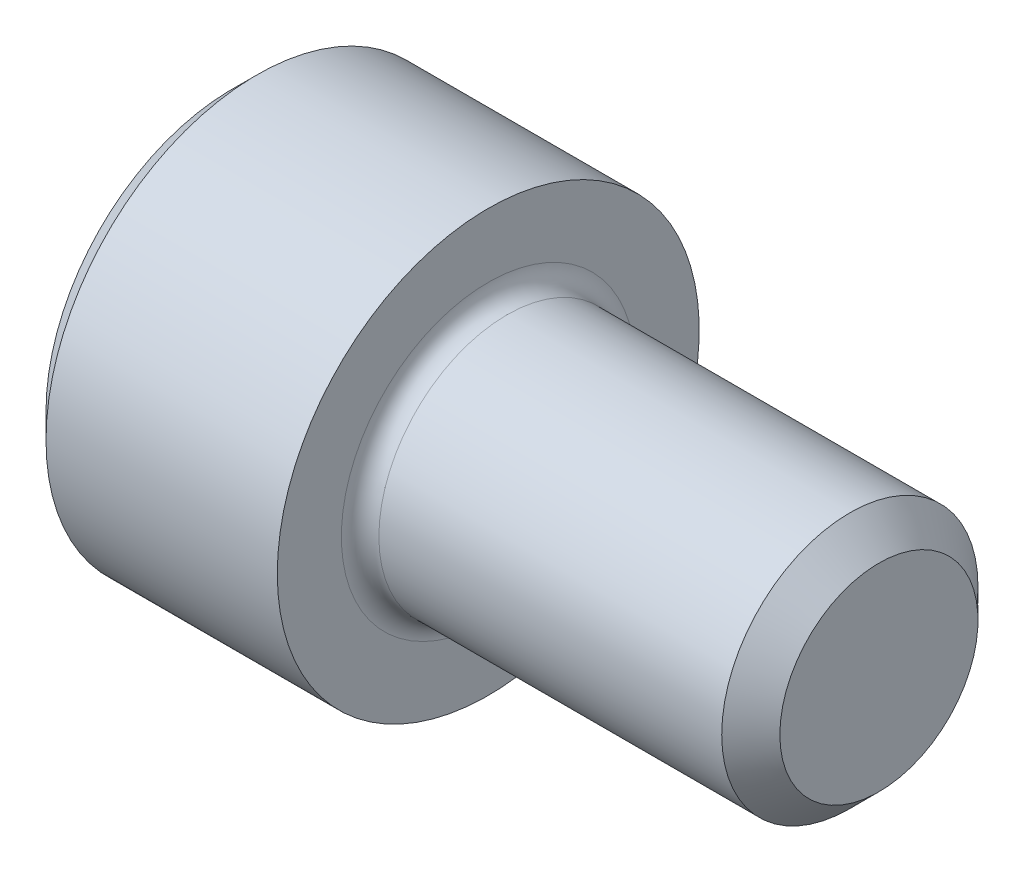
SolidWorks part; units mm, degrees
revolve "Base-Revolve" add sketch "BodySke"
sketch "BodySke" plane through (0, 0, 0) normal (0, 0, 1) x (1, 0, 0)
  line L0 (0, 0) -> (0, 3.0226)
  line L1 (0.4064, 3.429) -> (4.1656, 3.429)
  line L2 (4.1656, 3.429) -> (4.1656, 2.0828)
  line L3 (4.1656, 2.0828) -> (10.0432, 2.0828)
  line L4 (10.5156, 1.6104) -> (10.5156, 0)
  line L5 (10.5156, 0) -> (0, 0)
  line L6 (-31.75, 0) -> (127, 0) construction
  line L7 (0, 3.0226) -> (0.4064, 3.429)
  line L8 (10.5156, 1.6104) -> (10.0432, 2.0828)
  line L9 (0, -3.0226) -> (0.4064, -3.429) construction
  line L10 (10.5156, -1.6104) -> (10.0432, -2.0828) construction
  line L11 (4.9581, 9.525) -> (4.9581, 3.175) construction
  line L12 (4.1656, 9.525) -> (4.1656, 3.175) construction
  line L13 (-27.5844, 9.525) -> (-27.5844, 3.175) construction
  dimension "Diameter" = 4.1656
  dimension "Head_ht" = 4.1656
  dimension "Length" = 6.35
  dimension "Body_ch_ang" = 45
  dimension "Head_dia" = 6.858
  dimension "Head_ch_ang" = 45
  dimension "Head_side_ht" = 3.7592
  dimension "Minor_dia" = 3.2207
  dimension "Advance" = 0.7925
  dimension "Thread_nom" = 6.35
  dimension "Thread_length" = 38.1
fillet "Fillet1" radius 0.3048 1 edges at (4.1656, 0, 2.0828)
ref_plane "Plane1" through (0, 0, 0) normal (0, 0, 1) x (1, 0, 0)
ref_plane "Plane2" through (0, 0, 0) normal (0, 1, 0) x (1, 0, 0)
ref_plane "Plane3" through (0, 0, 0) normal (1, 0, 0) x (0, 0, -1)
sketch "Sketch2" plane through (0, 0, 0) normal (0, 0, 1) x (1, 0, 0)
  line L0 (0, 1.778) -> (1.9558, 1.778)
  line L1 (1.9558, 1.778) -> (2.9823, 0)
  line L2 (-31.75, 0) -> (127, 0) construction
  line L3 (2.9823, 0) -> (0, 0)
  line L4 (0, 0) -> (0, 1.778)
  line L5 (0, 3.0226) -> (0, -3.0226) construction
  line L6 (0, 0) -> (47.625, 0) construction
  line L7 (4.1656, -3.429) -> (4.1656, 3.429) construction
revolve "Hex-PreBroach" cut sketch "Sketch2" angle 360 about L6
sketch "Sketch3" plane through (0, 0, 0) normal (-1, 0, 0) x (0, 0.5, 0.866)
  line L0 (1.0265, 1.778) -> (-1.0265, 1.778)
  line L1 (-1.0265, 1.778) -> (-2.0531, 0)
  line L2 (1.0265, 1.778) -> (2.0531, 0)
  line L3 (1.0265, -1.778) -> (2.0531, 0)
  line L4 (1.0265, -1.778) -> (-1.0265, -1.778)
  line L5 (-1.0265, -1.778) -> (-2.0531, 0)
extrude "Hex" cut sketch "Sketch3" against normal blind 1.9558
sketch "Sketch4" plane through (0, 0, 0) normal (-1, 0, 0) x (0, 0, 1)
  line L0 (0, 0) -> (2.1971, 0)
  line L1 (0, 0) -> (6.1484, 3.5498) construction
  line L2 (0, 0) -> (1.0985, 1.9027)
  line L3 (1.8302, 0.5287) -> (2.0897, 0.6786)
  line L4 (1.373, 1.3206) -> (1.6325, 1.4704)
  arc A0 (1.8302, 0.5287) -> (1.373, 1.3206) centre (0, 0) ccw
  arc A1 (2.1971, 0) -> (2.0897, 0.6786) centre (0, 0) ccw
  arc A2 (1.0985, 1.9027) -> (1.6325, 1.4704) centre (0, 0) cw
extrude "Spline" [suppressed] cut sketch "Sketch4" against normal blind 1.9558
pattern_circular "CirPattern1" [suppressed] count 6 every 60
sketch "Sketch5" plane through (0, 0, 0) normal (0, 0, 1) x (1, 0, 0)
  line L0 (-31.75, 0) -> (127, 0) construction
  line L2 (0, 3.0226) -> (0, -3.0226) construction
  circle A0 centre (1.524, 0) radius 0.5905
  dimension "Drilled_hole_dia" = 1.1811
  dimension "Drilled_hole_loc" = 1.524
extrude "Hole" [suppressed] cut sketch "Sketch5" against normal through all and the other way through all
pattern_circular "Drilled-4" [suppressed] count 2 every 60
pattern_circular "Drilled-6" [suppressed] count 3 every 60
sketch "ThdSchSke" plane through (0, 0, 0) normal (0, 0, 1) x (1, 0, 0)
  line L0 (4.9581, -1.6104) -> (4.6273, -2.0828)
  line L1 (4.9581, -1.6104) -> (5.2889, -2.0828)
  line L2 (5.2889, -2.0828) -> (5.2889, -2.6035)
  line L3 (-3.175, 0) -> (5.1513, 0) construction
  line L5 (5.2889, -2.6035) -> (4.6273, -2.6035)
  line L6 (4.6273, -2.6035) -> (4.6273, -2.0828)
  line L7 (0, 3.0226) -> (0, -3.0226) construction
revolve "ThreadSchematic" [suppressed] cut sketch "ThdSchSke" angle 360 about L3
pattern_linear "ThdSchPat" [suppressed]
equation "\"D2@Sketch3\" = \"Hex_size@Sketch3\" / 2"
equation "\"D1@Sketch3\" = \"Hex_size@Sketch3\" / 2"
equation "\"D1@Sketch2\" = \"Hex_size@Sketch3\" / 2"
equation "\"D3@Sketch4\" = \"Spline_p_dim@Sketch4\" / 2"
equation "\"Thread_minor@ThreadCosmetic\"  =  \"Minor_dia@BodySke\""
equation "\"D2@CirPattern1\" = 360 / \"Num_teeth@CirPattern1\""
equation "\"Wall_thickness@Sketch2\" = \"Head_ht@BodySke\" - \"Key_eng@Hex\""
equation "\"Thread_length@ThreadCosmetic\" = ((sgn( (\"Length@BodySke\" - \"Advance@BodySke\" ) - \"Thread_nom@BodySke\" )-1)*( (\"Length@BodySke\" - \"Advance@BodySke\" ) - \"Thread_nom@BodySke\" ))/-2+ \"Thread_nom@BodySke\""
equation "\"Thread_minor@ThdSchSke\" = \"Minor_dia@BodySke\""
equation "\"Diameter@ThdSchSke\" = \"Diameter@BodySke\""
equation "\"Overcut@ThdSchSke\" = \"Diameter@BodySke\" * 1.25"
equation "\"Start@ThdSchSke\" = \"Head_ht@BodySke\" + \"Length@BodySke\" - \"Thread_length@ThreadCosmetic\"  '---Non-countersunk---"
equation "\"Num_threads@ThdSchPat\" = int( \"Thread_length@ThreadCosmetic\" / \"Advance@BodySke\" + 0.999 )  + 1"
equation "\"Advance@ThdSchPat\" = \"Thread_length@ThreadCosmetic\" /  (\"Num_threads@ThdSchPat\" - 1) 'relax it"
equation "\"Num_threads@ThdSchPat\" = \"Num_threads@ThdSchPat\" - sgn( \"Num_threads@ThdSchPat\" - 1) '---chamfered tips only---"
